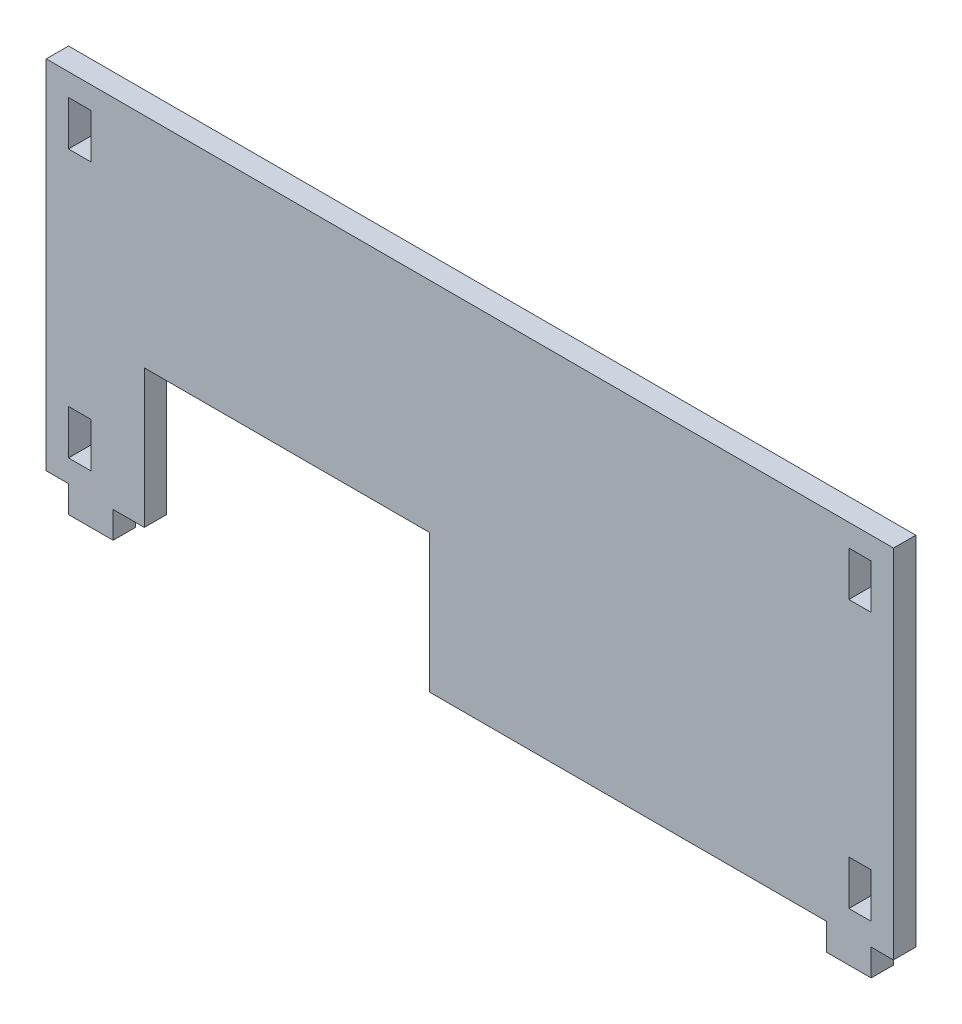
SolidWorks part; units mm, degrees
ref_plane "Front" through (0, 0, 0) normal (0, 0, 1) x (1, 0, 0)
ref_plane "Top" through (0, 0, 0) normal (0, 1, 0) x (1, 0, 0)
ref_plane "Right" through (0, 0, 0) normal (1, 0, 0) x (0, 0, -1)
sketch "Sketch1" plane through (0, 0, 0) normal (0, 0, 1) x (1, 0, 0)
  line L0 (60.325, 50.8) -> (60.325, 0) construction
  line L1 (0, 0) -> (3.175, 0)
  line L2 (0, 0) -> (0, 50.8)
  line L3 (0, 50.8) -> (120.65, 50.8)
  line L4 (120.65, 0) -> (120.65, 50.8)
  line L5 (117.475, 0) -> (120.65, 0)
  line L6 (3.175, 0) -> (3.175, -3.81)
  line L7 (3.175, -3.81) -> (9.525, -3.81)
  line L8 (9.525, 0) -> (9.525, -3.81)
  line L9 (117.475, -3.81) -> (111.125, -3.81)
  line L10 (111.125, 0) -> (111.125, -3.81)
  line L11 (117.475, 0) -> (117.475, -3.81)
  line L12 (9.525, 0) -> (13.97, 0)
  line L13 (0, 25.4) -> (120.65, 25.4) construction
  line L14 (3.175, 47.625) -> (6.35, 47.625)
  line L15 (3.175, 47.625) -> (3.175, 41.275)
  line L16 (3.175, 41.275) -> (6.35, 41.275)
  line L17 (6.35, 47.625) -> (6.35, 41.275)
  line L18 (3.175, 9.525) -> (6.35, 9.525)
  line L19 (6.35, 3.175) -> (6.35, 9.525)
  line L20 (3.175, 3.175) -> (6.35, 3.175)
  line L21 (3.175, 3.175) -> (3.175, 9.525)
  line L22 (117.475, 3.175) -> (114.3, 3.175)
  line L23 (114.3, 3.175) -> (114.3, 9.525)
  line L24 (117.475, 3.175) -> (117.475, 9.525)
  line L25 (117.475, 9.525) -> (114.3, 9.525)
  line L26 (117.475, 41.275) -> (114.3, 41.275)
  line L27 (114.3, 47.625) -> (114.3, 41.275)
  line L28 (117.475, 47.625) -> (117.475, 41.275)
  line L29 (117.475, 47.625) -> (114.3, 47.625)
  line L30 (54.61, 0) -> (111.125, 0)
  line L32 (13.97, 0) -> (13.97, 19.685)
  line L33 (13.97, 19.685) -> (54.61, 19.685)
  line L34 (54.61, 0) -> (54.61, 19.685)
  dimension "D1" = 50.8
  dimension "D2" = 120.65
  dimension "D3" = 6.35
  dimension "D4" = 3.81
  dimension "D5" = 3.175
  dimension "D6" = 6.35
  dimension "D7" = 3.175
  dimension "D8" = 3.175
  dimension "D9" = 3.175
  dimension "D10" = 40.64
  dimension "D11" = 19.685
  dimension "D12" = 7.62
extrude "Boss-Extrude1" add sketch "Sketch1" along normal blind 3.175
